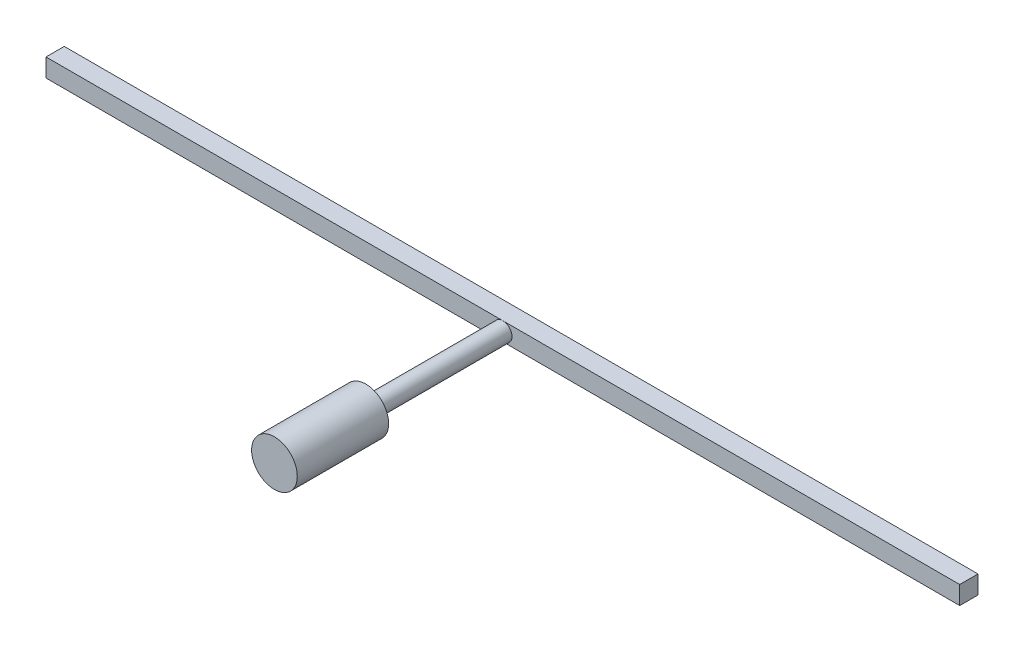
SolidWorks part; units mm, degrees
ref_plane "Plan1" through (0, 0, 0) normal (0, 0, 1) x (1, 0, 0)
ref_plane "Plan2" through (0, 0, 0) normal (0, 1, 0) x (1, 0, 0)
ref_plane "Plan3" through (0, 0, 0) normal (1, 0, 0) x (0, 0, -1)
sketch "Esquisse1" plane through (0, 0, 0) normal (0, 0, 1) x (1, 0, 0)
  circle A0 centre (0, 0) radius 5
  dimension "D1" = 10
extrude "Base-Extrusion" add sketch "Esquisse1" along normal mid plane 20
sketch "Esquisse2" plane through (0, 0, -10) normal (0, 0, -1) x (-1, 0, 0)
  circle A0 centre (0, 0) radius 2
  dimension "D1" = 4
extrude "Boss.-Extru.1" add sketch "Esquisse2" along normal blind 30
sketch "Esquisse3" plane through (0, 0, -40) normal (0, 0, -1) x (-1, 0, 0)
  line L1 (-100, 2) -> (100, 2)
  line L2 (-100, 2) -> (-100, -2)
  line L3 (-100, -2) -> (100, -2)
  line L4 (100, 2) -> (100, -2)
  dimension "D1" = 4
  dimension "D2" = 200
  dimension "D3" = 100
  dimension "D4" = 2
extrude "Boss.-Extru.2" add sketch "Esquisse3" along normal blind 4
